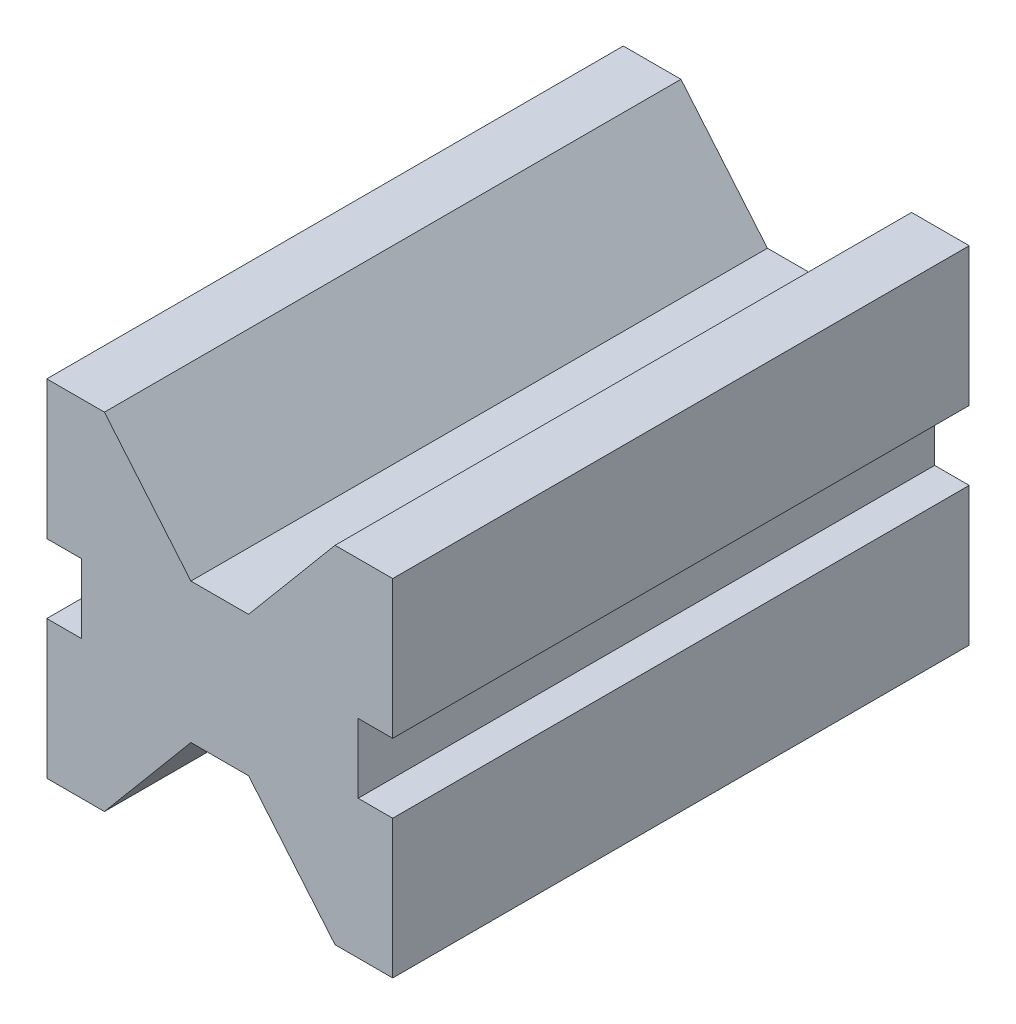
SolidWorks part; units mm, degrees
ref_plane "Front Plane" through (0, 0, 0) normal (0, 0, 1) x (1, 0, 0)
ref_plane "Top Plane" through (0, 0, 0) normal (0, 1, 0) x (1, 0, 0)
ref_plane "Right Plane" through (0, 0, 0) normal (1, 0, 0) x (0, 0, -1)
sketch "Sketch1" plane through (0, 0, 0) normal (0, 0, 1) x (1, 0, 0)
  line L1 (0, 0) -> (-60, 0)
  line L2 (0, 0) -> (0, 60)
  line L3 (0, 60) -> (-60, 60)
  line L4 (-60, 0) -> (-60, 60)
  dimension "D1" = 60
  dimension "D2" = 60
extrude "Extrude1" add sketch "Sketch1" against normal blind 100
sketch "Sketch2" plane through (0, 0, 0) normal (0, 0, 1) x (1, 0, 0)
  line L0 (-30, 0) -> (-30, 17.8763) construction
  line L1 (-60, 0) -> (0, 0) construction
  line L2 (0, 60) -> (-60, 60) construction
  line L3 (-50, 0) -> (-10, 0)
  line L4 (-10, 0) -> (-25, 17.8763)
  line L5 (-60, 30) -> (0, 30) construction
  line L6 (-60, 60) -> (-60, 0) construction
  line L7 (0, 0) -> (0, 60) construction
  line L8 (0, 36) -> (0, 24)
  line L9 (0, 24) -> (-6, 24)
  line L10 (-6, 24) -> (-6, 36)
  line L11 (-50, 60) -> (-10, 60)
  line L12 (-10, 60) -> (-25, 42.1237)
  line L13 (0, 36) -> (-6, 36)
  line L14 (-50, 0) -> (-35, 17.8763)
  line L15 (-60, 36) -> (-60, 24)
  line L16 (-60, 24) -> (-54, 24)
  line L17 (-54, 24) -> (-54, 36)
  line L18 (-60, 36) -> (-54, 36)
  line L19 (-50, 60) -> (-35, 42.1237)
  line L20 (-35, 17.8763) -> (-25, 17.8763)
  line L21 (-30, 23.8351) -> (-30, 36.1649) construction
  line L22 (-35, 42.1237) -> (-25, 42.1237)
  line L23 (-30, 42.1237) -> (-30, 60) construction
  point P20 (-6, 30)
  point P29 (-30, 17.8763)
  dimension "D1" = 40
  dimension "D2" = 24
  dimension "D3" = 6
  dimension "D4" = 10
  dimension "D5" = 50
extrude "Cut-Extrude1" cut sketch "Sketch2" against normal up to surface (100 mm away)
